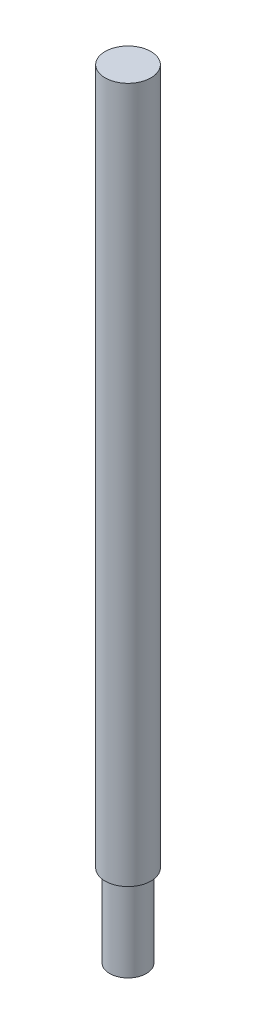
SolidWorks part; units mm, degrees
ref_plane "前视基准面" through (0, 0, 0) normal (0, 0, 1) x (1, 0, 0)
ref_plane "上视基准面" through (0, 0, 0) normal (0, 1, 0) x (1, 0, 0)
ref_plane "右视基准面" through (0, 0, 0) normal (1, 0, 0) x (0, 0, -1)
sketch "草图1" plane through (0, 0, 0) normal (0, 1, 0) x (1, 0, 0)
  circle A0 centre (0, 0) radius 5
  dimension "D1" = 10
extrude "凸台-拉伸1" add sketch "草图1" along normal blind 170
sketch "草图2" plane through (0, 0, 0) normal (0, -1, 0) x (1, 0, 0)
  circle A0 centre (0, 0) radius 5
  circle A1 centre (0, 0) radius 4
  dimension "D1" = 10
  dimension "D2" = 8
extrude "切除-拉伸1" cut sketch "草图2" against normal blind 18
